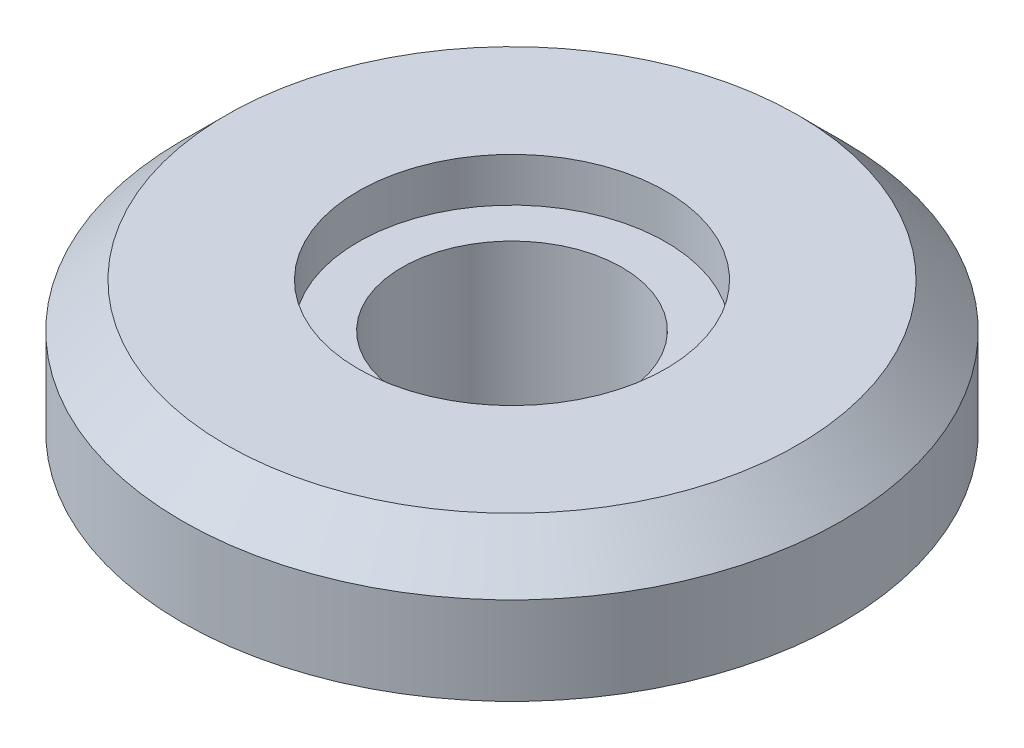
SolidWorks part; units mm, degrees
ref_plane "Front Plane" through (0, 0, 0) normal (0, 0, 1) x (1, 0, 0)
ref_plane "Top Plane" through (0, 0, 0) normal (0, 1, 0) x (1, 0, 0)
ref_plane "Right Plane" through (0, 0, 0) normal (1, 0, 0) x (0, 0, -1)
sketch "Sketch1" plane through (0, 0, 0) normal (0, 0, 1) x (1, 0, 0)
  line L0 (0, 13.2767) -> (0, 0) construction
  line L1 (0, 0) -> (13.4223, 0) construction
  line L2 (5, 0) -> (7.5, 0)
  line L3 (7.5, 0) -> (7.5, 5)
  line L4 (7.5, 5) -> (15, 5)
  line L5 (15, 5) -> (15, 9)
  line L6 (15, 9) -> (13, 11)
  line L7 (13, 11) -> (7, 11)
  line L8 (7, 11) -> (7, 9)
  line L9 (7, 9) -> (5, 9)
  line L10 (5, 9) -> (5, 0)
  dimension "D1" = 7.5
  dimension "D2" = 5
  dimension "D3" = 5
  dimension "D4" = 7.5
  dimension "D5" = 4
  dimension "D6" = 2
  dimension "D7" = 2
  dimension "D8" = 6
  dimension "D9" = 2
revolve "Revolve1" add sketch "Sketch1" angle 360 about L0
